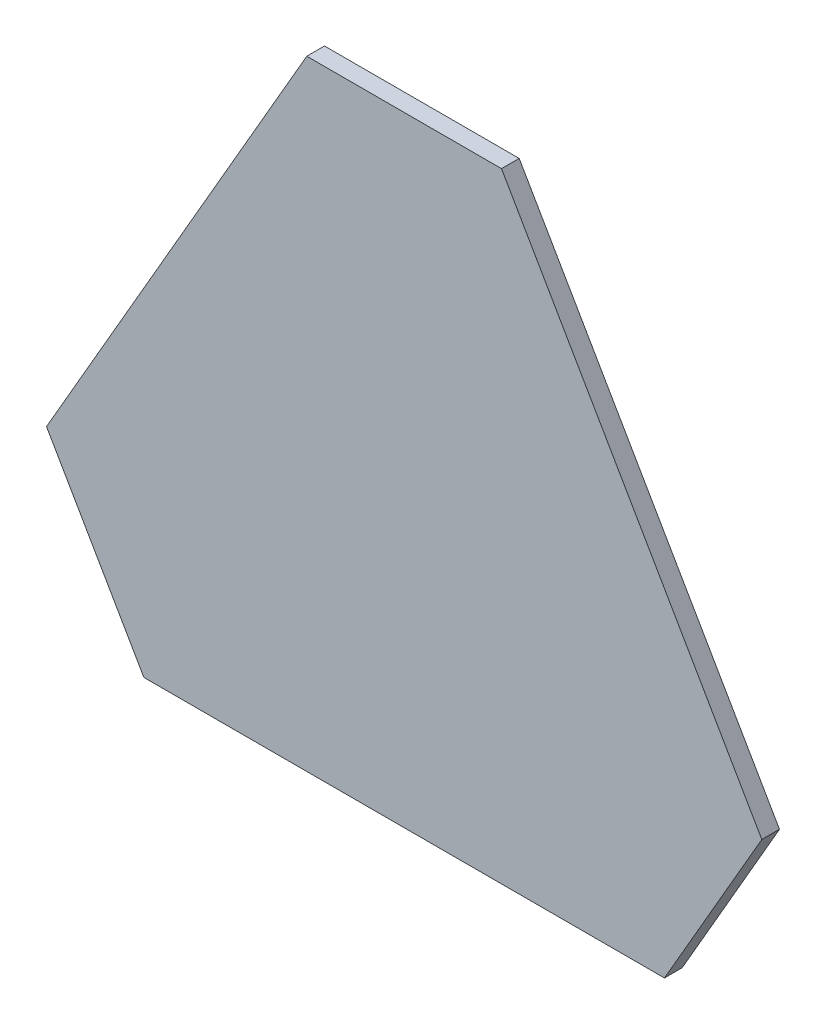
SolidWorks part; units mm, degrees
ref_plane "Plan de face" through (0, 0, 0) normal (0, 0, 1) x (1, 0, 0)
ref_plane "Plan de dessus" through (0, 0, 0) normal (0, 1, 0) x (1, 0, 0)
ref_plane "Plan de droite" through (0, 0, 0) normal (1, 0, 0) x (0, 0, -1)
sketch "Esquisse1" plane through (0, 0, 0) normal (0, 0, 1) x (1, 0, 0)
  line L0 (35.7636, 358.7862) -> (-423.8647, -437.3133) construction
  line L1 (-755.4678, -148.4209) -> (879.7592, -148.4209) construction
  line L2 (-46.1325, 376.7457) -> (415.4529, -422.7436) construction
  line L3 (257.0726, -148.4209) -> (-250.0871, 144.3878) construction
  line L4 (-257.0726, -148.4209) -> (279.7796, 161.5309) construction
  line L5 (-55, 201.5791) -> (55, 201.5791)
  line L6 (-147.0726, -148.4209) -> (147.0726, -148.4209)
  line L7 (147.0726, -148.4209) -> (202.0726, -53.1581)
  line L8 (202.0726, -53.1581) -> (55, 201.5791)
  line L9 (-147.0726, -148.4209) -> (-202.0726, -53.1581)
  line L10 (-202.0726, -53.1581) -> (-55, 201.5791)
  point P16 (0, 0)
  dimension "D1" = 60
  dimension "D2" = 60
  dimension "D3" = 350
  dimension "D4" = 110
  dimension "D5" = 110
  dimension "D6" = 110
  dimension "D7" = 60
  dimension "D8" = 60
extrude "Boss.-Extru.1" add sketch "Esquisse1" along normal blind 10
